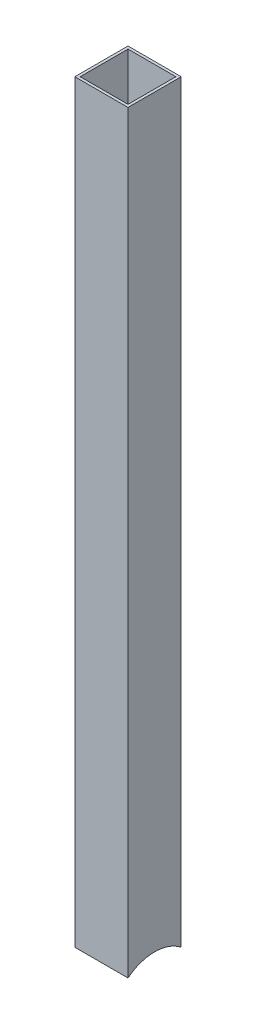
SolidWorks part; units mm, degrees
ref_plane "Front Plane" through (0, 0, 0) normal (0, 0, 1) x (1, 0, 0)
ref_plane "Top Plane" through (0, 0, 0) normal (0, 1, 0) x (1, 0, 0)
ref_plane "Right Plane" through (0, 0, 0) normal (1, 0, 0) x (0, 0, -1)
sketch "Sketch1" plane through (0, 0, 0) normal (0, 1, 0) x (1, 0, 0)
  line L1 (-25, 25) -> (25, 25)
  line L2 (-25, 25) -> (-25, -25)
  line L3 (-25, -25) -> (25, -25)
  line L4 (25, 25) -> (25, -25)
  line L5 (-25, 25) -> (25, -25) construction
  line L6 (-25, -25) -> (25, 25) construction
  point P0 (0, 0)
  dimension "D1" = 50
extrude "Boss-Extrude1" add sketch "Sketch1" along normal blind 740
shell "Shell1" thickness 2.5
sketch "Sketch2" plane through (-25, 0, 0) normal (-1, 0, 0) x (0, 0, 1)
  circle A0 centre (0, 0) radius 40
extrude "Cut-Extrude1" cut sketch "Sketch2" against normal through all
